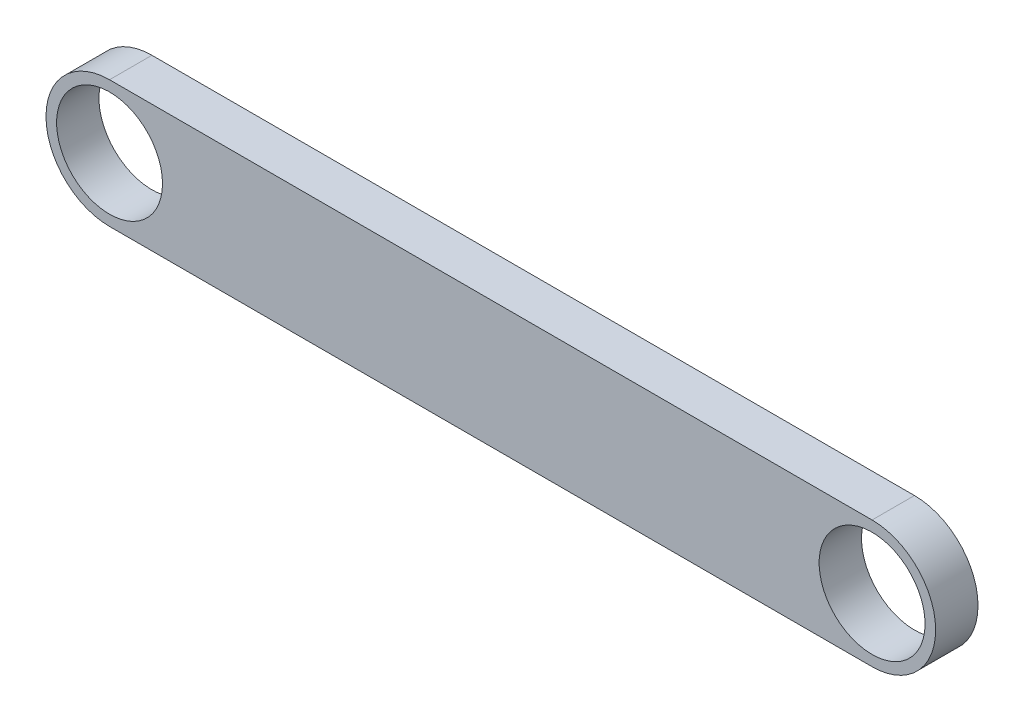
SolidWorks part; units mm, degrees
ref_plane "Front Plane" through (0, 0, 0) normal (0, 0, 1) x (1, 0, 0)
ref_plane "Top Plane" through (0, 0, 0) normal (0, 1, 0) x (1, 0, 0)
ref_plane "Right Plane" through (0, 0, 0) normal (1, 0, 0) x (0, 0, -1)
sketch "Sketch1" plane through (0, 0, 0) normal (0, 0, 1) x (1, 0, 0)
  line L0 (0, 0) -> (180, 0) construction
  line L1 (0, 15) -> (180, 15)
  line L2 (0, -15) -> (180, -15)
  arc A0 (0, 15) -> (0, -15) centre (0, 0) ccw
  arc A1 (180, -15) -> (180, 15) centre (180, 0) ccw
  circle A2 centre (0, 0) radius 12.5
  circle A3 centre (180, 0) radius 12.5
  point P3 (90, 0)
  dimension "D1" = 15
  dimension "D3" = 25
  dimension "D4" = 25
  dimension "D2" = 180
extrude "Boss-Extrude1" add sketch "Sketch1" along normal blind 10
